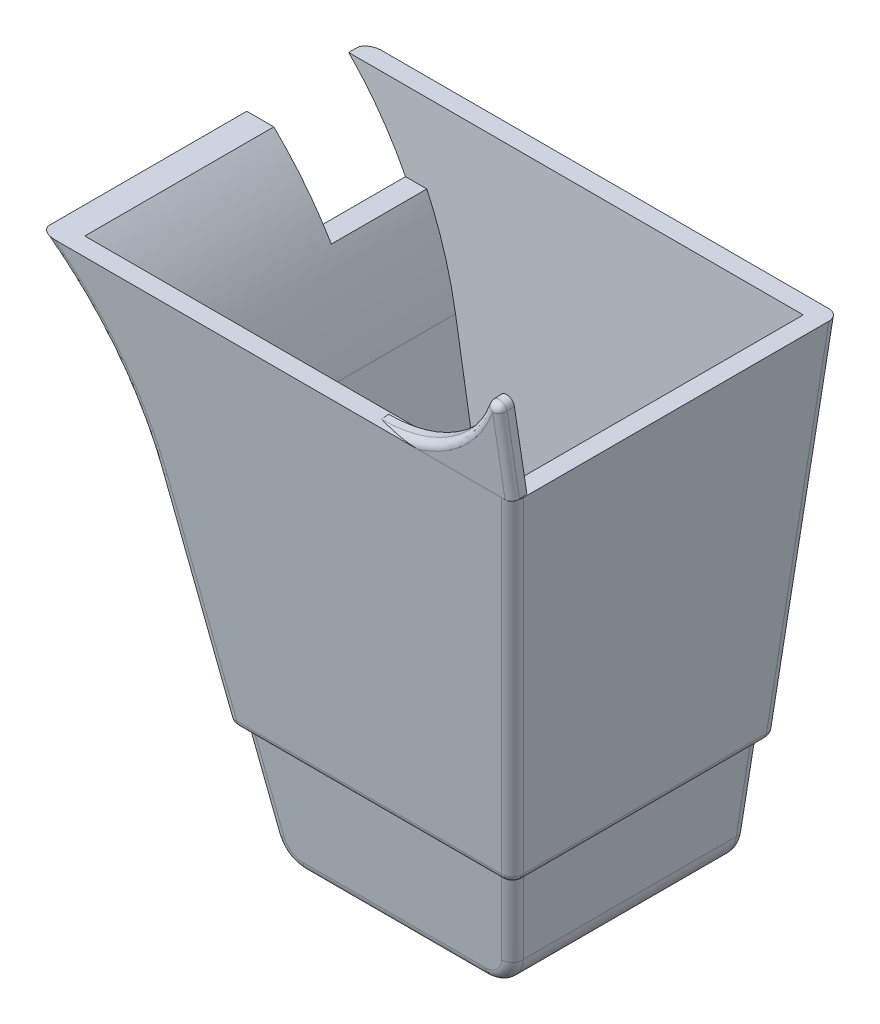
SolidWorks part; units mm, degrees
other "<Pied>-<Congé12>"
other "<Pied>-<Enlèv. mat.-Extru.4>"
ref_plane "Plan de face" through (0, 0, 0) normal (0, 0, 1) x (1, 0, 0)
ref_plane "Plan de dessus" through (0, 0, 0) normal (0, 1, 0) x (1, 0, 0)
ref_plane "Plan de droite" through (0, 0, 0) normal (1, 0, 0) x (0, 0, -1)
mirrored part "Pied_Symétrique"
